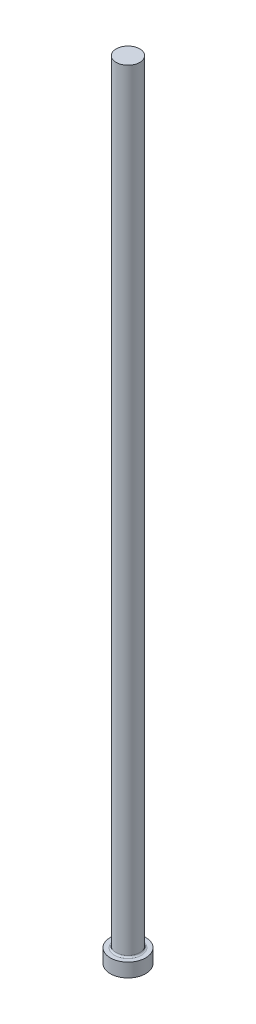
SolidWorks part; units mm, degrees
ref_plane "Plano frontal" through (0, 0, 0) normal (0, 0, 1) x (1, 0, 0)
ref_plane "Plano superior" through (0, 0, 0) normal (0, 1, 0) x (1, 0, 0)
ref_plane "Plano direito" through (0, 0, 0) normal (1, 0, 0) x (0, 0, -1)
sketch "Esboço1" plane through (0, 0, 0) normal (0, 0, 1) x (1, 0, 0)
  line L0 (0, 0) -> (9, 0)
  line L1 (9, 0) -> (9, 7)
  line L2 (9, 7) -> (6.8, 7)
  line L3 (6, 7.8) -> (6, 400)
  line L4 (6, 400) -> (0, 400)
  line L5 (0, 400) -> (0, 0) construction
  line L6 (0, 0) -> (0, 400)
  arc A0 (6.8, 7) -> (6, 7.8) centre (6.8, 7.8) cw
  dimension "D3" = 0.8
  dimension "D1" = 18
  dimension "D2" = 12
  dimension "D4" = 7
  dimension "D5" = 400
revolve "Revolução1" add sketch "Esboço1" angle 360 about L5
sketch "Esboço2"
  dimension "D1" = 1.0125
  dimension "D2" = 1.575
  dimension "D3" = 0.675
  dimension "D4" = 4.8375
wrap "Envolver1" sketch "Esboço2" wrap type deboss source sketch "Esboço2" thickness 0.1 parameters "D1"=0.1
